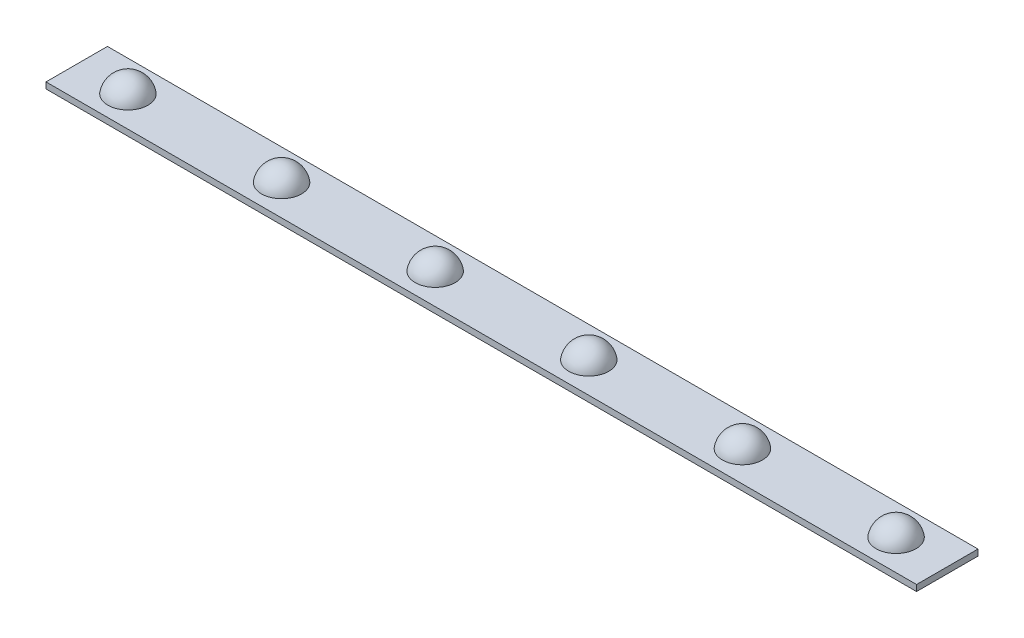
SolidWorks part; units mm, degrees
ref_plane "Front Plane" through (0, 0, 0) normal (0, 0, 1) x (1, 0, 0)
ref_plane "Top Plane" through (0, 0, 0) normal (0, 1, 0) x (1, 0, 0)
ref_plane "Right Plane" through (0, 0, 0) normal (1, 0, 0) x (0, 0, -1)
imported_body "Imported3"
sketch "Sketch1" plane through (-237.363, 0, 0) normal (-1, 0, 0) x (0, 0, 1)
  line L0 (2.6321, 19.5554) -> (2.6321, 18.7934)
  line L1 (2.6321, 18.7934) -> (0.1524, 18.7934)
  line L2 (0.1524, 18.7934) -> (-2.3273, 18.7934)
  line L3 (-2.3273, 18.7934) -> (-2.3273, 19.5554)
  line L4 (-2.3273, 19.5554) -> (0.1524, 19.5554)
  line L5 (0.1524, 19.5554) -> (2.6321, 19.5554)
  line L6 (2.6321, 19.5554) -> (-2.3273, 19.5554) construction
  dimension "D1" = 2.4797
  dimension "D2" = 4.9594
  dimension "D3" = 0.762
extrude "Boss-Extrude1" add sketch "Sketch1" along normal blind 2.4797
sketch "Sketch2" plane through (-142.113, 0, 0) normal (1, 0, 0) x (0, 0, -1)
  line L0 (-2.6321, 19.5554) -> (-0.1524, 19.5554)
  line L1 (-0.1524, 19.5554) -> (2.3273, 19.5554)
  line L2 (2.3273, 19.5554) -> (2.3273, 18.7934)
  line L3 (2.3273, 18.7934) -> (-0.1524, 18.7934)
  line L4 (-0.1524, 18.7934) -> (-2.6321, 18.7934)
  line L5 (-2.6321, 18.7934) -> (-2.6321, 19.5554)
  line L6 (-2.6321, 18.7934) -> (-2.6321, 19.5554) construction
  line L7 (-2.6321, 19.5554) -> (2.3273, 19.5554) construction
  dimension "D1" = 2.4797
  dimension "D2" = 4.9594
  dimension "D3" = 0.762
extrude "Boss-Extrude2" add sketch "Sketch2" along normal blind 2.4797
sketch "Sketch3" plane through (0, 0, 2.6321) normal (0, 0, 1) x (1, 0, 0)
  line L0 (-239.8427, 18.7934) -> (-239.8427, 19.5554)
  line L1 (-239.8427, 19.5554) -> (-139.6333, 19.5554)
  line L2 (-139.6333, 19.5554) -> (-139.6333, 18.7934)
  line L3 (-139.6333, 18.7934) -> (-239.8427, 18.7934)
  line L4 (-239.8427, 18.7934) -> (-239.8427, 19.5554) construction
  line L5 (-239.8427, 18.7934) -> (-237.363, 18.7934) construction
  dimension "D1" = 100.2094
  dimension "D2" = 0.762
extrude "Boss-Extrude3" add sketch "Sketch3" along normal blind 1.3303
sketch "Sketch4" plane through (-239.8427, 0, 0) normal (-1, 0, 0) x (0, 0, 1)
  line L0 (-2.3273, 18.7934) -> (-2.3273, 19.5554)
  line L1 (-2.3273, 19.5554) -> (3.9624, 19.5554)
  line L2 (3.9624, 19.5554) -> (3.9624, 18.7934)
  line L3 (3.9624, 18.7934) -> (-2.3273, 18.7934)
  line L4 (3.9624, 19.5554) -> (0.1524, 19.5554) construction
  dimension "D1" = 6.2897
  dimension "D2" = 0.762
extrude "Boss-Extrude4" add sketch "Sketch4" along normal blind 3.8703
sketch "Sketch5" plane through (-139.6333, 0, 0) normal (1, 0, 0) x (0, 0, -1)
  line L0 (2.3273, 18.7934) -> (-3.9624, 18.7934)
  line L1 (-3.9624, 18.7934) -> (-3.9624, 19.5554)
  line L2 (-3.9624, 19.5554) -> (2.3273, 19.5554)
  line L3 (2.3273, 19.5554) -> (2.3273, 18.7934)
  line L4 (-3.9624, 18.7934) -> (-0.1524, 18.7934) construction
  dimension "D1" = 2.4797
  dimension "D2" = 3.81
  dimension "D3" = 0.762
extrude "Boss-Extrude5" add sketch "Sketch5" along normal blind 3.8703
sketch "Sketch6" plane through (0, 0, -2.3273) normal (0, 0, -1) x (-1, 0, 0)
  line L0 (135.763, 18.7934) -> (135.763, 19.5554)
  line L1 (135.763, 19.5554) -> (243.713, 19.5554)
  line L2 (243.713, 19.5554) -> (243.713, 18.7934)
  line L3 (243.713, 18.7934) -> (135.763, 18.7934)
  line L4 (243.713, 19.5554) -> (243.713, 18.7934) construction
  line L5 (243.713, 18.7934) -> (237.363, 18.7934) construction
  dimension "D1" = 107.95
  dimension "D2" = 0.762
extrude "Boss-Extrude6" add sketch "Sketch6" along normal blind 1.3303
